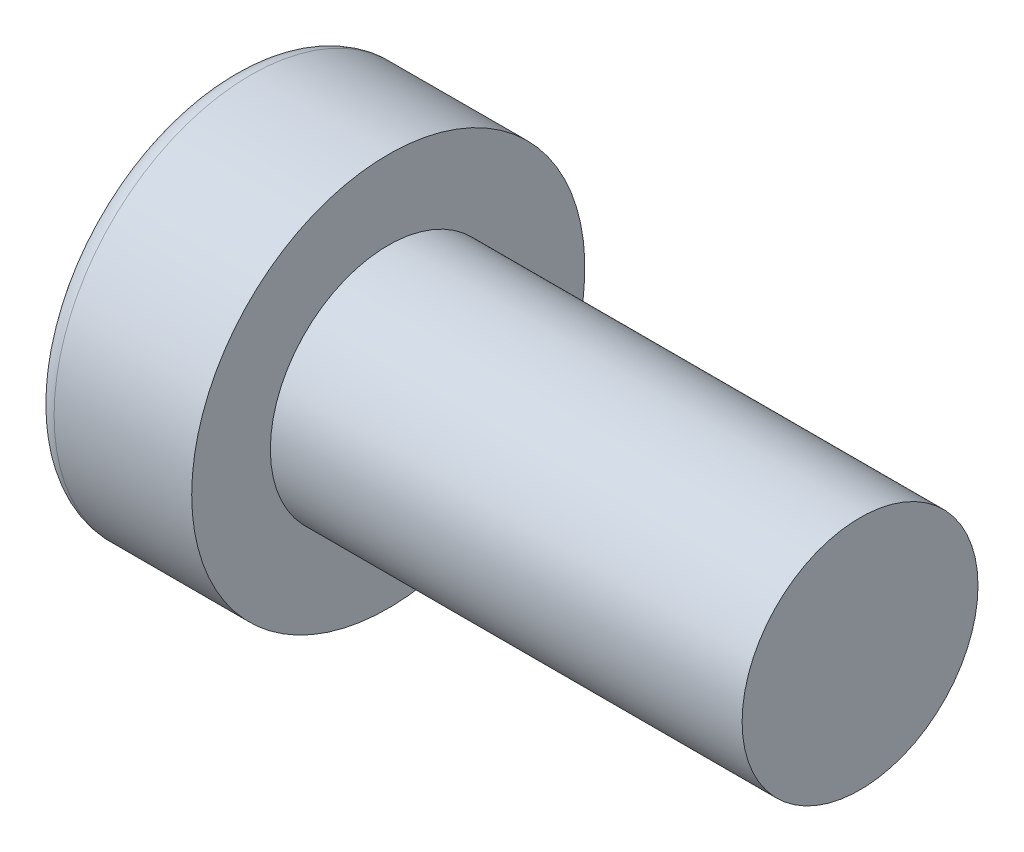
SolidWorks part; units mm, degrees
ref_plane "Ebene vorne" through (0, 0, 0) normal (0, 0, 1) x (1, 0, 0)
ref_plane "Ebene oben" through (0, 0, 0) normal (0, 1, 0) x (1, 0, 0)
ref_plane "Ebene rechts" through (0, 0, 0) normal (1, 0, 0) x (0, 0, -1)
sketch "Skizze1" plane through (0, 0, 0) normal (0, 0, 1) x (1, 0, 0)
  line L0 (-65.0118, 0) -> (64.6036, 0) construction
  line L1 (-16, 0) -> (-16, 5)
  line L2 (-16, 5) -> (-12, 5)
  line L3 (-12, 5) -> (-12, 3)
  line L4 (-12, 3) -> (0, 3)
  line L5 (0, 3) -> (0, 0)
  line L6 (0, 0) -> (-16, 0)
  dimension "D1" = 6
  dimension "D2" = 12
  dimension "D3" = 10
  dimension "D4" = 4
revolve "Rotation1" add sketch "Skizze1" angle 360 about L0
fillet "Verrundung1" radius 0.5 1 edges at (-16, 0, 5)
sketch "Skizze2" plane through (-16, 0, 0) normal (-1, 0, 0) x (0, 0, 1)
  line L1 (2, 1.1547) -> (0, 2.3094)
  line L2 (0, 2.3094) -> (-2, 1.1547)
  line L3 (-2, 1.1547) -> (-2, -1.1547)
  line L4 (-2, -1.1547) -> (0, -2.3094)
  line L5 (0, -2.3094) -> (2, -1.1547)
  line L6 (2, -1.1547) -> (2, 1.1547)
  circle A0 centre (0, 0) radius 2 construction
  dimension "D1" = 4
extrude "Schnitt-Linear austragen1" cut sketch "Skizze2" against normal blind 3
